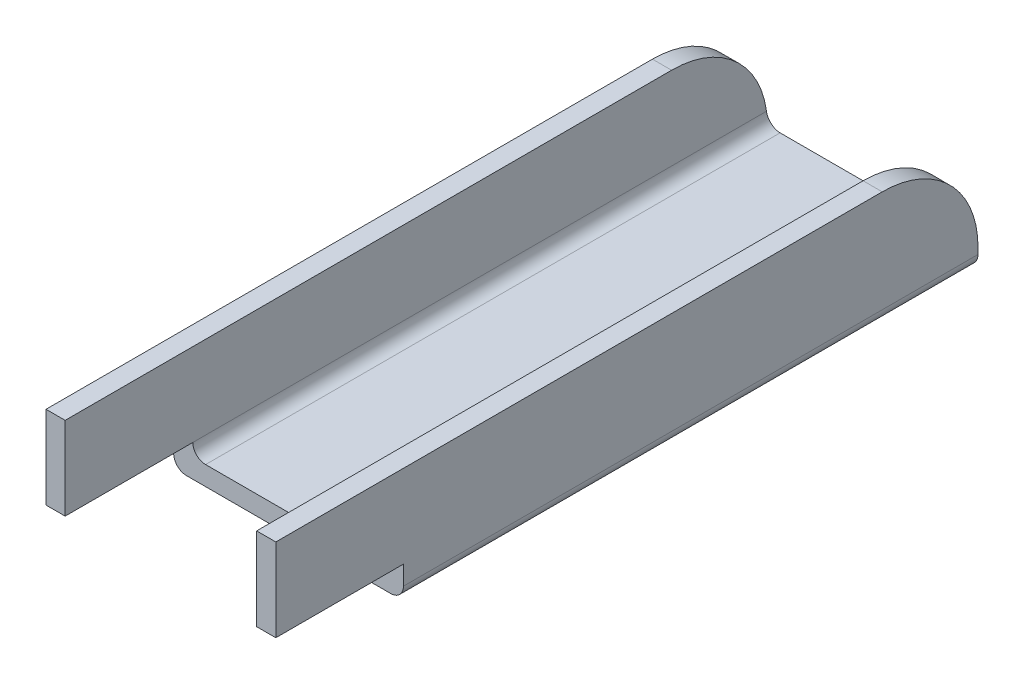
SolidWorks part; units mm, degrees
ref_plane "Plan de face" through (0, 0, 0) normal (0, 0, 1) x (1, 0, 0)
ref_plane "Plan de dessus" through (0, 0, 0) normal (0, 1, 0) x (1, 0, 0)
ref_plane "Plan de droite" through (0, 0, 0) normal (1, 0, 0) x (0, 0, -1)
sketch "Esquisse1" plane through (0, 0, 0) normal (0, 0, 1) x (1, 0, 0)
  line L0 (0, 15) -> (0, 0)
  line L1 (0, 0) -> (30, 0)
  line L2 (30, 0) -> (30, 15)
extrude "Extru.-Mince1" add sketch "Esquisse1" against normal blind 110 thin
sketch "Esquisse3" plane through (33, 0, 0) normal (1, 0, 0) x (0, 0, -1)
  line L1 (0, -3) -> (20, -3)
  line L2 (0, -3) -> (0, 2)
  line L3 (0, 2) -> (20, 2)
  line L4 (20, -3) -> (20, 2)
extrude "Extrusion1" cut sketch "Esquisse3" against normal blind 110
fillet "Congé4" radius 2 1 edges at (-3, -3, -65)
fillet "Congé5" radius 2 1 edges at (33, -3, -65)
fillet "Congé6" radius 2 1 edges at (0, 0, -65)
fillet "Congé7" radius 2 1 edges at (30, 0, -65)
fillet "Congé8" radius 15 1 edges at (-1.5, 15, -110)
fillet "Congé9" radius 15 1 edges at (31.5, 15, -110)
